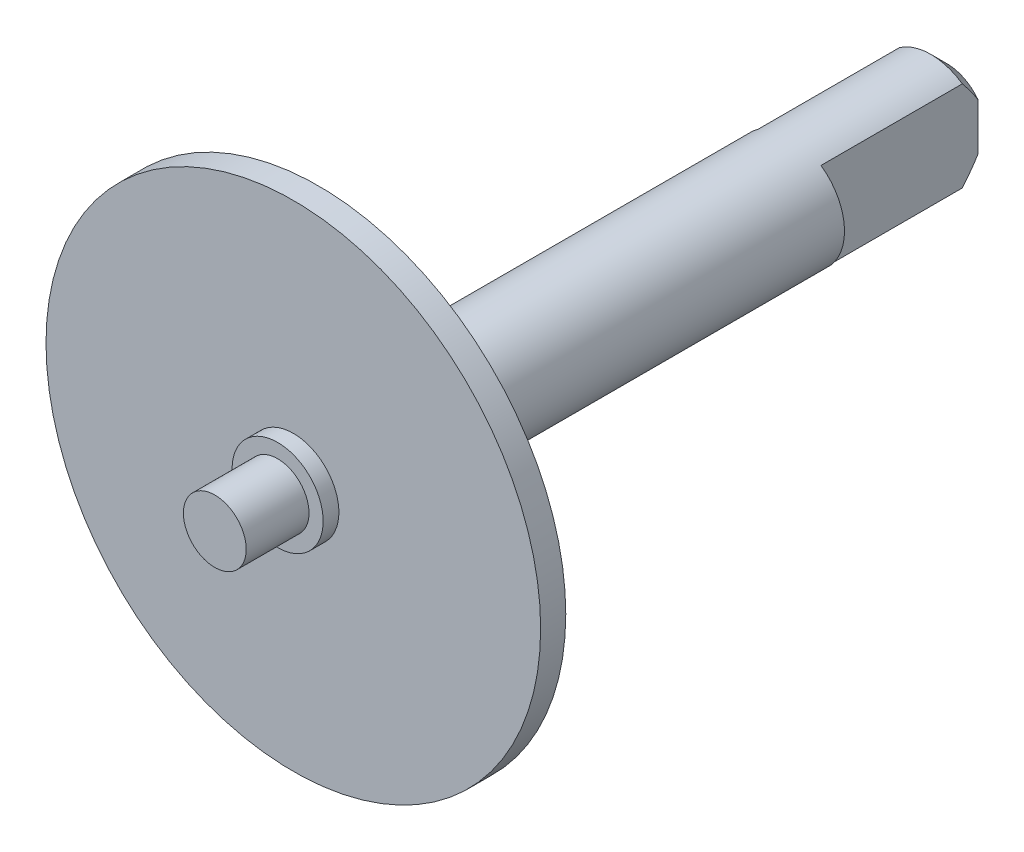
SolidWorks part; units mm, degrees
ref_plane "Přední" through (0, 0, 0) normal (0, 0, 1) x (1, 0, 0)
ref_plane "Horní" through (0, 0, 0) normal (0, 1, 0) x (1, 0, 0)
ref_plane "Pravá" through (0, 0, 0) normal (1, 0, 0) x (0, 0, -1)
sketch "Skica1" plane through (0, 0, 0) normal (0, 0, 1) x (1, 0, 0)
  circle A0 centre (10, 0) radius 1.75 construction
  circle A1 centre (10, 0) radius 1.75
extrude "Základ-Protažení" add sketch "Skica1" against normal blind 15 and the other way blind 2.5
sketch "Skica2" plane through (0, 0, 0) normal (0, 1, 0) x (1, 0, 0)
  line L0 (10, 15) -> (10, -2.5) construction
  line L3 (9, 15) -> (9, 10)
  line L4 (11.75, 15) -> (8.25, 15) construction
  line L5 (11, 15) -> (11, 10)
  line L6 (9, 10) -> (8.25, 10)
  line L7 (8.25, 15) -> (8.25, -2.5) construction
  line L8 (11, 10) -> (11.75, 10)
  line L9 (9, 15) -> (11, 15)
  line L11 (8.25, -2.5) -> (11.75, -2.5) construction
  dimension "D1" = 5
  dimension "D2" = 2
extrude "Odebrání-Protažení1" cut sketch "Skica2" against normal through all and the other way through all
chamfer "Zkosení2" distance 0.5 angle 45 3 edges at (10, -1.75, -15) (10, 1.75, -15) (9, 0, -15)
sketch "Skica4" plane through (0, 0, 0) normal (0, 1, 0) x (1, 0, 0)
  line L0 (10, -2.5) -> (10, -9.2889) construction
  line L1 (8.25, -2.5) -> (11.75, -2.5) construction
  line L2 (10, -2.5) -> (12.05, -2.5)
  line L3 (12.05, -2.5) -> (12.05, -5)
  line L4 (12.05, -5) -> (17.875, -5)
  line L5 (17.875, -5) -> (17.875, -5.8)
  line L6 (17.875, -5.8) -> (11.45, -5.8)
  line L7 (11.45, -5.8) -> (11.45, -6.3)
  line L8 (11.45, -6.3) -> (11, -6.3)
  line L9 (11, -6.3) -> (11, -8.3)
  line L10 (11, -8.3) -> (10, -8.3)
  line L11 (10, -2.5) -> (10, -8.3)
  dimension "D1" = 15.75
  dimension "D2" = 2.9
  dimension "D3" = 4.1
  dimension "D4" = 2.5
  dimension "D5" = 0.8
  dimension "D6" = 3.3
  dimension "D7" = 2
  dimension "D8" = 2
revolve "Přidání-Rotační1" add sketch "Skica4" angle 360 about L0
